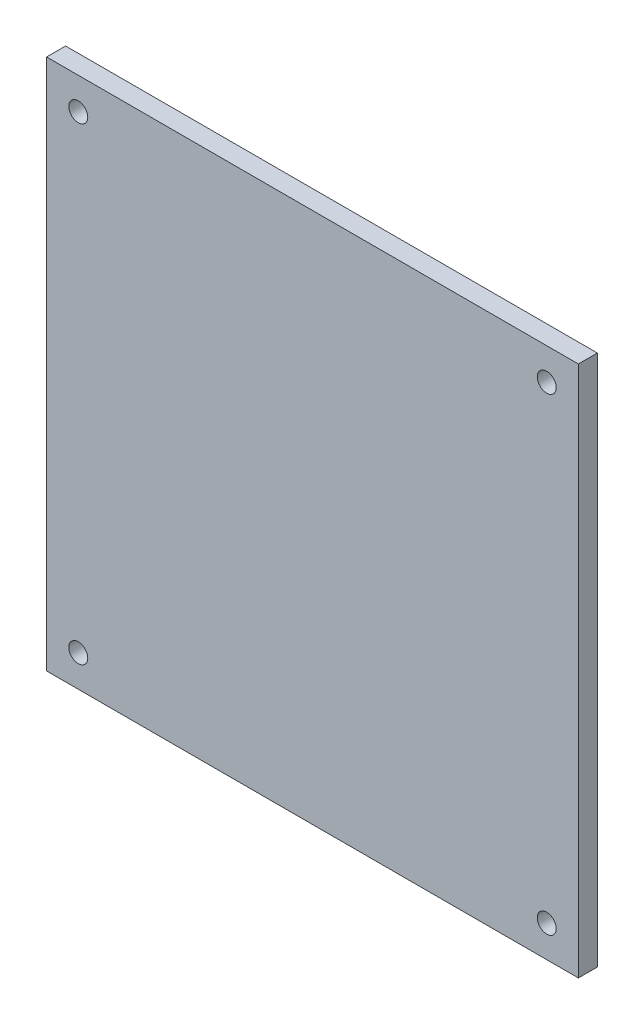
SolidWorks part; units mm, degrees
ref_plane "Piano frontale" through (0, 0, 0) normal (0, 0, 1) x (1, 0, 0)
ref_plane "Piano superiore" through (0, 0, 0) normal (0, 1, 0) x (1, 0, 0)
ref_plane "Piano destro" through (0, 0, 0) normal (1, 0, 0) x (0, 0, -1)
sketch "Sketch1" plane through (0, 0, 0) normal (0, 0, 1) x (1, 0, 0)
  line L1 (-42, 42) -> (42, 42)
  line L2 (-42, 42) -> (-42, -42)
  line L3 (-42, -42) -> (42, -42)
  line L4 (42, 42) -> (42, -42)
  line L5 (-42, 42) -> (42, -42) construction
  line L6 (-42, -42) -> (42, 42) construction
  circle A0 centre (-37, 37) radius 1.5
  circle A1 centre (37, 37) radius 1.5
  circle A2 centre (37, -37) radius 1.5
  circle A3 centre (-37, -37) radius 1.5
  dimension "D6" = 3
  dimension "D1" = 84
  dimension "D2" = 84
  dimension "D5" = 5
  dimension "D7" = 4
extrude "Boss-Extrude1" add sketch "Sketch1" along normal blind 3
sketch "Sketch3" plane through (0, 0, 0) normal (0, 0, -1) x (-1, 0, 0)
  circle A26 centre (19.05, 33.02) radius 1.5875
  circle A27 centre (-8.89, 33.02) radius 1.5875
  circle A28 centre (24.13, -19.05) radius 1.5875
  circle A29 centre (-24.13, -17.78) radius 1.5875
extrude "Cut-Extrude1" cut sketch "Sketch3" against normal blind 1
